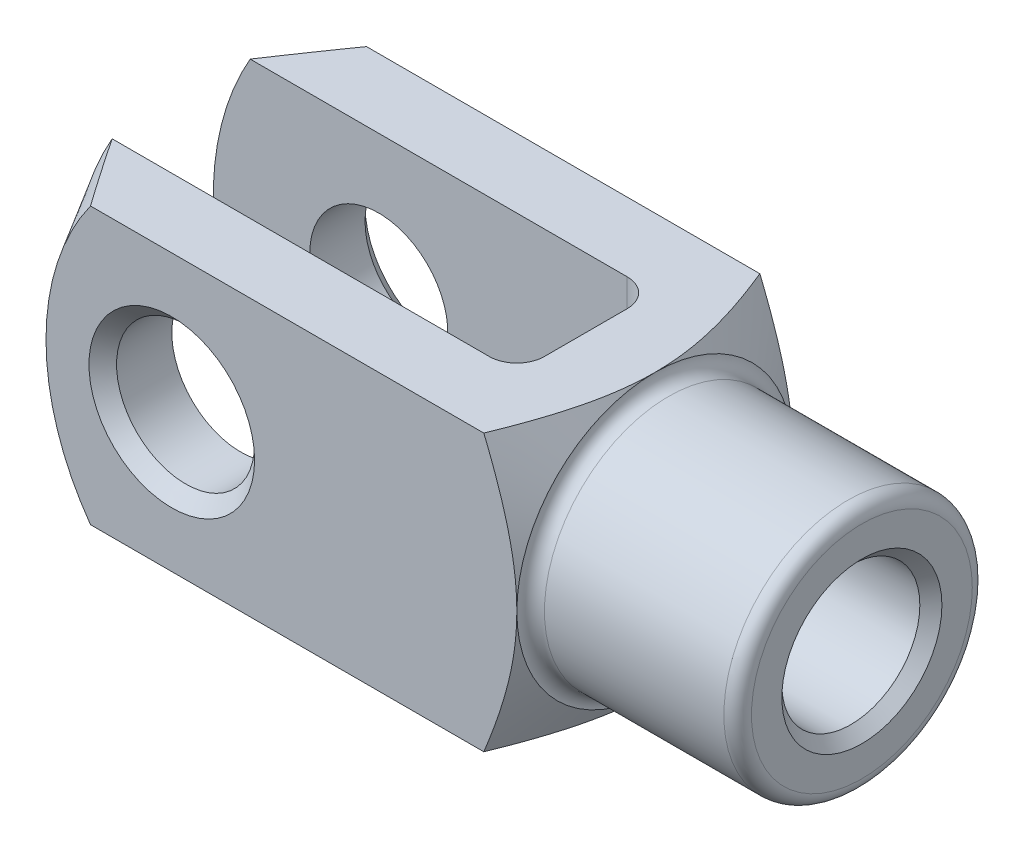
SolidWorks part; units mm, degrees
ref_plane "Front Plane" through (0, 0, 0) normal (0, 0, 1) x (1, 0, 0)
ref_plane "Top Plane" through (0, 0, 0) normal (0, 1, 0) x (1, 0, 0)
ref_plane "Right Plane" through (0, 0, 0) normal (1, 0, 0) x (0, 0, -1)
sketch "Sketch1" plane through (0, 0, 0) normal (1, 0, 0) x (0, 0, -1)
  line L0 (0, 0) -> (0, 50000) construction
  line L1 (0, 0) -> (50000, 0) construction
  line L2 (-5, -5) -> (-5, 5)
  line L3 (-5, 5) -> (5, 5)
  line L4 (5, -5) -> (5, 5)
  line L5 (-5, -5) -> (5, -5)
  point P9 (0, 5)
  point P11 (5, 0)
  point P12 (-5, 0)
  dimension "D1" = 10
  dimension "D2" = 10
extrude "Extrude1" add sketch "Sketch1" against normal blind 26
sketch "Sketch2" plane through (0, 0, 0) normal (1, 0, 0) x (0, 0, -1)
  circle A0 centre (0, 0) radius 4.5
  circle A1 centre (0, 0) radius 9
  dimension "D1" = 9
  dimension "D2" = 18
extrude "Extrude2" cut sketch "Sketch2" against normal blind 7.5
sketch "Sketch3" plane through (0, 0, 5) normal (0, 0, 1) x (1, 0, 0)
  circle A0 centre (-20, 0) radius 2.5
  dimension "D1" = 5
  dimension "D2" = 20
extrude "Extrude3" cut sketch "Sketch3" against normal through all
sketch "Sketch4" plane through (0, 5, 0) normal (0, 1, 0) x (1, 0, 0)
  line L0 (0, 0) -> (-50000, 0) construction
  line L1 (-26, -2.5) -> (-26, 2.5)
  line L2 (-26, 5) -> (-26, -5) construction
  line L3 (-26, 2.5) -> (-10, 2.5)
  line L4 (-10, 2.5) -> (-10, -2.5)
  line L5 (-20, 5) -> (-20, -5) construction
  line L6 (-26, -2.5) -> (-10, -2.5)
  point P7 (-20, 0)
  point P13 (-10, 0)
  point P14 (-26, 0)
  dimension "D1" = 10
  dimension "D2" = 5
extrude "Extrude4" cut sketch "Sketch4" against normal through all
fillet "Fillet1" radius 1 2 edges at (-10, 0, 2.5) (-10, 0, -2.5)
fillet "Fillet2" radius 0.5 2 edges at (0, 0, -4.5) (-7.5, 0, -4.5)
chamfer "Chamfer2" distance 0.5 angle 45 2 edges at (-17.5, 0, -5) (-17.5, 0, 5)
sketch "Sketch6" plane through (0, 0, 0) normal (0, 0, 1) x (1, 0, 0)
  line L0 (-7.5, -5) -> (-7.5, -10)
  line L1 (-7.5, -10) -> (-10.3868, -10)
  line L2 (-10.3868, -10) -> (-7.5, -5)
  dimension "D1" = 30
  dimension "D2" = 10
revolve "Cut-Revolve1" cut sketch "Sketch6" angle 360 about axis through (-7.5, 0, 0) along (1, 0, 0)
sketch "Sketch7" plane through (0, 0, 0) normal (0, 1, 0) x (1, 0, 0)
  line L0 (-24.5566, -5) -> (-26, -2.5)
  line L1 (-26, 2.5) -> (-24.5566, 5)
  line L2 (-24.5566, 5) -> (-36, 5)
  line L3 (-26, 2.5) -> (-26, -2.5)
  line L4 (-36, 5) -> (-36, -5)
  line L5 (-36, -5) -> (-24.5566, -5)
  line L6 (-26, 5) -> (-8.6957, 5) construction
  line L7 (-26, -5) -> (-8.6957, -5) construction
  line L8 (-16, 0.6162) -> (-16, 50000.6162) construction
  dimension "D1" = 120
  dimension "D2" = 10
  dimension "D3" = 10
revolve "Cut-Revolve2" cut sketch "Sketch7" angle 180 about L8
sketch "Sketch8" plane through (0, 0, 0) normal (1, 0, 0) x (0, 0, -1)
  circle A0 centre (0, 0) radius 2.5
  dimension "D1" = 5
extrude "Extrude5" cut sketch "Sketch8" against normal through all
chamfer "Chamfer3" distance 0.4 angle 45 1 edges at (0, 0, -2.5)
equation "\"D2@Sketch1\" = \"D1@Sketch1\""
equation "\"D2@Sketch2\" = \"D1@Sketch2\"*2"
equation "\"D2@Sketch6\" = \"D1@Sketch1\""
equation "\"D2@Sketch7\" = \"D1@Sketch1\""
equation "\"D3@Sketch7\" = \"D1@Sketch1\""
